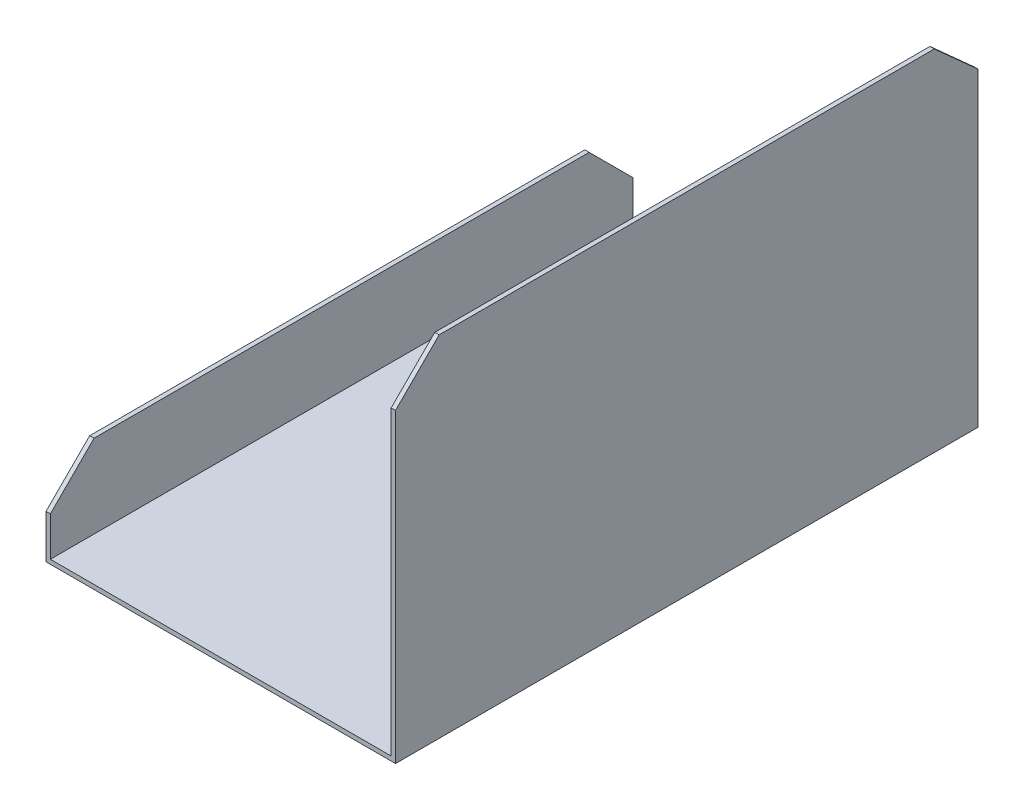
SolidWorks part; units mm, degrees
ref_plane "Plan de face" through (0, 0, 0) normal (0, 0, 1) x (1, 0, 0)
ref_plane "Plan de dessus" through (0, 0, 0) normal (0, 1, 0) x (1, 0, 0)
ref_plane "Plan de droite" through (0, 0, 0) normal (1, 0, 0) x (0, 0, -1)
sketch "Esquisse1" plane through (0, 0, 0) normal (0, 0, 1) x (1, 0, 0)
  line L0 (0, 28.5) -> (0, 0)
  line L1 (0, 0) -> (117, 0)
  line L2 (117, 0) -> (117, 118.5)
  line L3 (-1.5, 28.5) -> (-1.5, -1.5)
  line L4 (-1.5, -1.5) -> (118.5, -1.5)
  line L5 (118.5, -1.5) -> (118.5, 118.5)
  line L6 (0, 28.5) -> (-1.5, 28.5)
  line L7 (118.5, 118.5) -> (117, 118.5)
  dimension "D2" = 120
  dimension "D3" = 120
  dimension "D4" = 30
  dimension "D1" = 1.5
extrude "Extrusion1" add sketch "Esquisse1" along normal blind 200
sketch "Esquisse9" plane through (118.5, 0, 0) normal (1, 0, 0) x (0, 0, -1)
  line L0 (-200, 103.5) -> (-185, 118.5)
  line L1 (-200, -1.5) -> (-200, 118.5) construction
  line L2 (-200, 118.5) -> (0, 118.5) construction
  dimension "D1" = 105
extrude "Enlèv. mat.-Extru.8" cut sketch "Esquisse9" against normal through all and the other way through all
sketch "Esquisse12" plane through (118.5, 0, 0) normal (1, 0, 0) x (0, 0, -1)
  line L0 (-15, 118.5) -> (0, 105)
  line L1 (-185, 118.5) -> (0, 118.5) construction
  line L2 (0, -1.5) -> (0, 118.5) construction
  dimension "D1" = 105
  dimension "D2" = 170
extrude "Enlèv. mat.-Extru.9" cut sketch "Esquisse12" against normal through all and the other way through all
chamfer "Chanfrein1" distance 15 distance2 15 2 edges at (-0.75, 28.5, 0) (-0.75, 28.5, 200)
